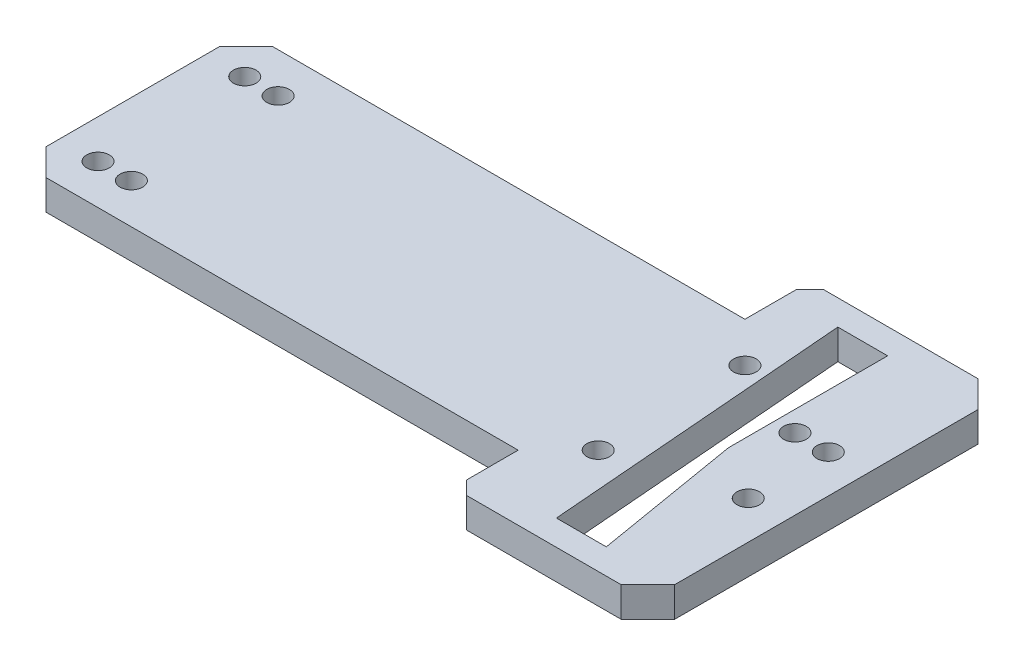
SolidWorks part; units mm, degrees
ref_plane "Front Plane" through (0, 0, 0) normal (0, 0, 1) x (1, 0, 0)
ref_plane "Top Plane" through (0, 0, 0) normal (0, 1, 0) x (1, 0, 0)
ref_plane "Right Plane" through (0, 0, 0) normal (1, 0, 0) x (0, 0, -1)
sketch "Sketch11" plane through (0, 0, 0) normal (0, 1, 0) x (1, 0, 0)
  line L0 (43.25, -0.9121) -> (46.9642, -22.95)
  line L1 (-47, 13) -> (-43, 17)
  line L2 (-43, 17) -> (27.8, 17)
  line L3 (53, 26.75) -> (29.8, 26.75)
  line L4 (27.8, 17) -> (27.8, 24.75)
  line L5 (27.8, 24.75) -> (29.8, 26.75)
  line L6 (27.8, -24.75) -> (29.8, -26.75)
  line L8 (27.8, -17) -> (27.8, -24.75)
  line L9 (53, -26.75) -> (29.8, -26.75)
  line L10 (-43, -17) -> (27.8, -17)
  line L11 (-47, -13) -> (-43, -17)
  line L15 (39.4842, -22.95) -> (35.7832, 22.95)
  line L17 (46.9642, -22.95) -> (39.4842, -22.95)
  line L19 (35.7832, 22.95) -> (43.25, 22.95)
  line L20 (43.25, 22.95) -> (43.25, -0.9121)
  line L25 (-47, 13) -> (-47, -13)
  line L30 (57, -22.75) -> (57, 22.75)
  line L36 (57, 22.75) -> (53, 26.75)
  line L38 (53, -26.75) -> (57, -22.75)
  circle A4 centre (-41.2, 11) radius 1.7
  circle A7 centre (-41.2, -11) radius 1.7
  circle A8 centre (-36.2, 11) radius 1.7
  circle A11 centre (-36.2, -11) radius 1.7
  circle A64 centre (33.8, 11) radius 1.7
  circle A67 centre (33.8, -11) radius 1.7
  circle A73 centre (46.3, 6) radius 1.7
  circle A77 centre (51.3, 6) radius 1.7
  circle A78 centre (51.3, -6) radius 1.7
  point P7 (27.8, 26.75)
  point P10 (27.8, -26.75)
extrude "Boss-Extrude4" add sketch "Sketch11" along normal blind 4.5
